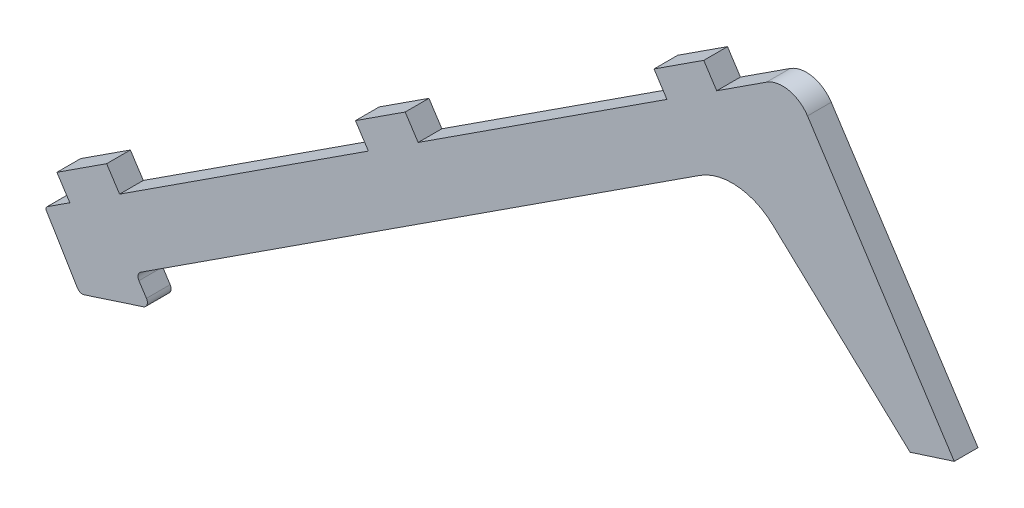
SolidWorks part; units mm, degrees
ref_plane "Front Plane" through (0, 0, 0) normal (0, 0, 1) x (1, 0, 0)
ref_plane "Top Plane" through (0, 0, 0) normal (0, 1, 0) x (1, 0, 0)
ref_plane "Right Plane" through (0, 0, 0) normal (1, 0, 0) x (0, 0, -1)
sketch "Sketch1" plane through (0, 0, 0) normal (0, 0, 1) x (1, 0, 0)
  line L3 (39.5353, 18.0559) -> (130.3059, 77.0474)
  line L5 (161.1266, 120.9304) -> (6.1239, 4.5962) construction
  line L6 (166.5759, 112.5456) -> (216.0318, 36.4477)
  line L7 (152.7418, 115.4811) -> (135.9721, 104.5825)
  line L10 (154.8538, 74.8961) -> (196.0318, 36.4477)
  line L16 (6.1239, 4.5962) -> (90.804, 38.7093) construction
  line L17 (135.9721, 104.5825) -> (131.6127, 111.2904)
  line L18 (131.6127, 111.2904) -> (114.8431, 100.3918)
  line L19 (114.8431, 100.3918) -> (119.2025, 93.684)
  line L20 (-82.0334, -37.0988) -> (-86.3928, -30.3909)
  line L21 (-86.3928, -30.3909) -> (-69.6232, -19.4923)
  line L22 (-69.6232, -19.4923) -> (-65.2637, -26.2002)
  line L23 (161.1266, 120.9304) -> (-90.4182, -42.548) construction
  line L24 (35.3542, 39.1912) -> (30.9948, 45.899)
  line L25 (30.9948, 45.899) -> (14.2251, 35.0005)
  line L26 (14.2251, 35.0005) -> (18.5845, 28.2926)
  line L27 (35.3542, 39.1912) -> (119.2025, 93.684)
  line L28 (-65.2637, -26.2002) -> (18.5845, 28.2926)
  line L29 (196.0318, 36.4477) -> (201.1482, 31.6704)
  line L30 (201.1482, 31.6704) -> (216.0318, 36.4477)
  line L47 (-82.0334, -37.0988) -> (-89.6073, -42.0211)
  line L62 (-58.7449, -48.2015) -> (-56.2153, -52.0939)
  line L63 (-89.9187, -43.3761) -> (-79.4849, -60.6706)
  line L64 (39.5353, 18.0559) -> (-58.1578, -45.4347)
  line L65 (-57.2747, -55.086) -> (-77.1549, -61.5397)
  arc A0 (130.3059, 77.0474) -> (154.8538, 74.8961) centre (141.2044, 60.2778) cw
  arc A1 (152.7418, 115.4811) -> (166.5759, 112.5456) centre (158.1911, 107.0963) cw
  arc A9 (-89.9187, -43.3761) -> (-89.6073, -42.0211) centre (-89.0624, -42.8595) cw
  arc A12 (-79.4849, -60.6706) -> (-77.1549, -61.5397) centre (-77.7724, -59.6374) ccw
  arc A13 (-56.2153, -52.0939) -> (-57.2747, -55.086) centre (-57.8922, -53.1837) cw
  arc A14 (-58.7449, -48.2015) -> (-58.1578, -45.4347) centre (-57.068, -47.1117) cw
  point P1 (0, 0)
  point P7 (143.4211, 85.571)
  point P21 (-54.7941, -54.2807)
  point P48 (-59.8348, -46.5245)
  dimension "D1" = 20
  dimension "D2" = 10
  dimension "D3" = 9.2503
  dimension "D28" = 2
  dimension "D26" = 2
  dimension "D23" = 2
  dimension "D7" = 1
  dimension "D4" = 20
  dimension "D5" = 300
  dimension "D8" = 8
  dimension "D9" = 8
  dimension "D10" = 20
  dimension "D11" = 8
  dimension "D12" = 20
  dimension "D13" = 20
  dimension "D14" = 8
  dimension "D15" = 8
  dimension "D16" = 8
  dimension "D17" = 30
  dimension "D18" = 10
  dimension "D19" = 220
  dimension "D20" = 100
  dimension "D21" = 100
  dimension "D22" = 56.3375
  dimension "D24" = 90.7567
  dimension "D25" = 103.944
  dimension "D27" = 7
extrude "Boss-Extrude1" add sketch "Sketch1" along normal blind 8
